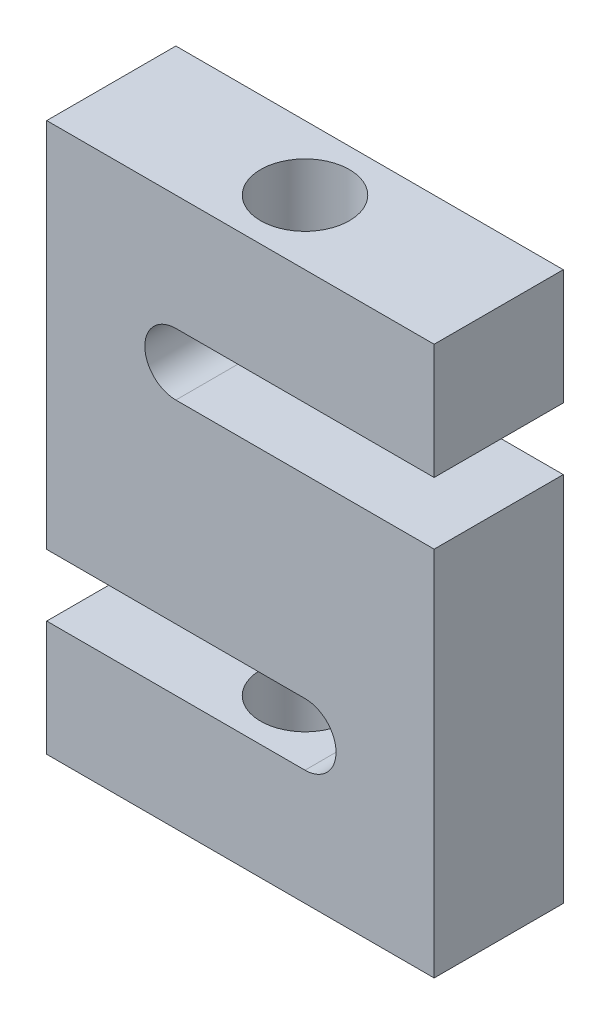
SolidWorks part; units mm, degrees
ref_plane "Front" through (0, 0, 0) normal (0, 0, 1) x (1, 0, 0)
ref_plane "Top" through (0, 0, 0) normal (0, 1, 0) x (1, 0, 0)
ref_plane "Right" through (0, 0, 0) normal (1, 0, 0) x (0, 0, -1)
sketch "Sketch2" plane through (0, 0, 0) normal (0, 0, 1) x (1, 0, 0)
  line L0 (-115.7484, 0) -> (180.4341, 0) construction
  line L1 (-38.1, 53.975) -> (38.1, 53.975)
  line L2 (-38.1, 53.975) -> (-38.1, -19.075)
  line L3 (-38.1, -53.975) -> (38.1, -53.975)
  line L4 (38.1, 53.975) -> (38.1, 31.275)
  line L5 (-38.1, 53.975) -> (38.1, -53.975) construction
  line L6 (-38.1, -53.975) -> (38.1, 53.975) construction
  line L7 (38.1, 31.275) -> (-12.7, 31.275)
  line L8 (-38.1, -19.075) -> (12.7, -19.075)
  line L9 (38.1, 19.075) -> (-12.7, 19.075)
  line L10 (-12.7, 31.275) -> (-12.7, 19.075) construction
  line L11 (38.1, 31.275) -> (-12.7, 19.075) construction
  line L12 (38.1, 19.075) -> (-12.7, 31.275) construction
  line L13 (38.1, 19.075) -> (38.1, -53.975)
  line L14 (12.7, -19.075) -> (12.7, -31.275) construction
  line L15 (12.7, -31.275) -> (-38.1, -31.275)
  line L16 (-38.1, -31.275) -> (-38.1, -53.975)
  arc A0 (-12.7, 31.275) -> (-12.7, 19.075) centre (-12.7, 25.175) ccw
  arc A1 (12.7, -31.275) -> (12.7, -19.075) centre (12.7, -25.175) ccw
  point P0 (0, 0)
  point P10 (12.7, 25.175)
extrude "Boss-Extrude1" add sketch "Sketch2" along normal mid plane 25.4
hole_wizard "3/4-16 Tapped Hole1" positions "Sketch3" profile "Sketch4" tap size "3/4-16" standard "ANSI Inch"
sketch "Sketch3" plane through (0, 53.975, 0) normal (0, 1, 0) x (1, 0, 0)
  point P0 (0, 0)
sketch "Sketch4" plane through (0, 53.975, 0) normal (1, 0, 0) x (0, 0, 1)
  line L0 (0, 0) -> (0, 73.05)
  line L1 (0, 73.05) -> (8.7312, 73.05)
  line L2 (8.7312, 73.05) -> (8.7312, 0)
  line L5 (8.7312, 0) -> (0, 0)
  line L11 (0, -6.35) -> (0, 107.95) construction
  dimension "Thru Tap Drill Dia." = 17.4625
  dimension "Thru Tap Drill Depth" = 73.05
mirror "Mirror1" about plane through (0, 0, 0) normal (0, 1, 0) of "3/4-16 Tapped Hole1"
equation "\"D7@Sketch2\"=\"D3@Sketch2\""
equation "\"D8@Sketch2\"=\"D4@Sketch2\""
equation "\"D6@Sketch2\"=\"D5@Sketch2\""
